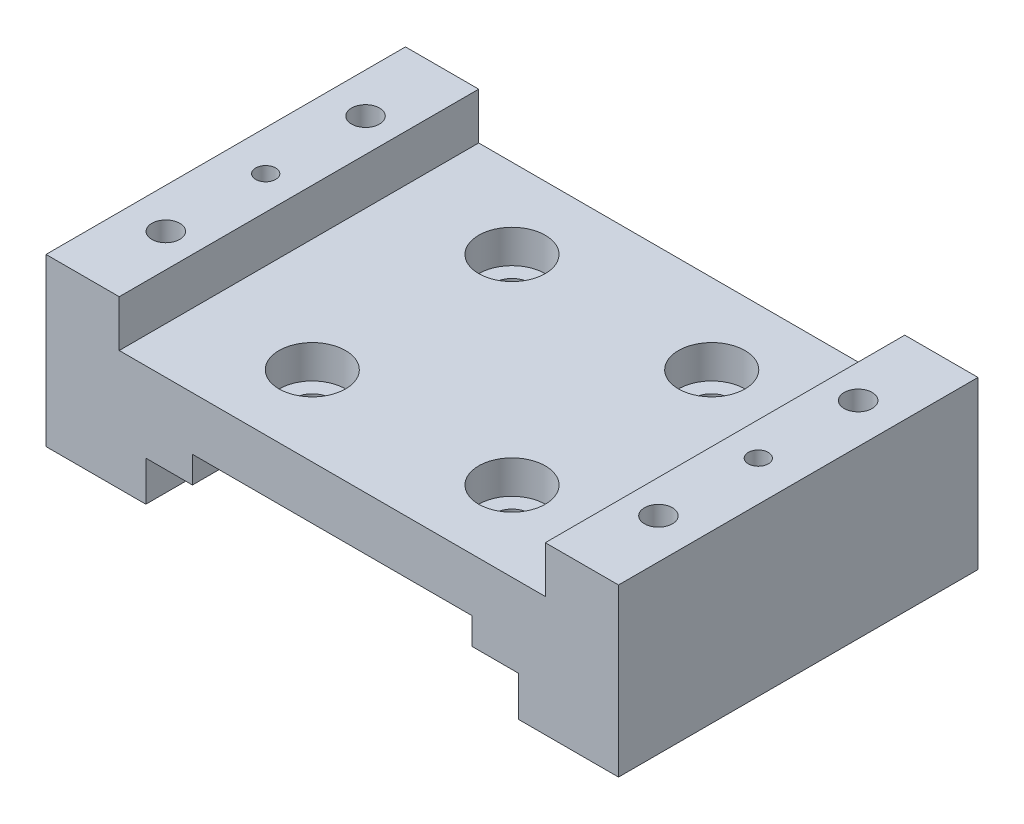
SolidWorks part; units mm, degrees
ref_plane "Front" through (0, 0, 0) normal (0, 0, 1) x (1, 0, 0)
ref_plane "Top" through (0, 0, 0) normal (0, 1, 0) x (1, 0, 0)
ref_plane "Right" through (0, 0, 0) normal (1, 0, 0) x (0, 0, -1)
sketch "Sketch1" plane through (0, 0, 0) normal (0, 0, 1) x (1, 0, 0)
  line L0 (-21, 0) -> (21, 0)
  line L1 (21, 0) -> (21, -4)
  line L2 (21, -4) -> (28, -4)
  line L3 (28, -4) -> (28, -10)
  line L4 (28, -10) -> (43, -10)
  line L5 (43, -10) -> (43, 15)
  line L6 (43, 15) -> (32, 15)
  line L7 (32, 15) -> (32, 8)
  line L8 (32, 8) -> (-32, 8)
  line L9 (0, 8) -> (0, 0) construction
  line L10 (-32, 15) -> (-32, 8)
  line L11 (-43, 15) -> (-32, 15)
  line L12 (-43, -10) -> (-43, 15)
  line L13 (-28, -10) -> (-43, -10)
  line L14 (-28, -4) -> (-28, -10)
  line L15 (-21, -4) -> (-28, -4)
  line L16 (-21, 0) -> (-21, -4)
  dimension "D1" = 25
  dimension "D2" = 6
  dimension "D3" = 4
  dimension "D4" = 8
  dimension "D5" = 7
  dimension "D6" = 43
  dimension "D7" = 11
  dimension "D8" = 15
  dimension "D9" = 7
extrude "Extrude1" add sketch "Sketch1" along normal blind 54
sketch "Sketch2" plane through (0, 15, 0) normal (0, 1, 0) x (1, 0, 0)
  line L0 (32, 0) -> (-32, 0) construction
  line L1 (-37, -12) -> (37, -12) construction
  line L2 (-37, -12) -> (-37, -42) construction
  line L3 (-37, -42) -> (37, -42) construction
  line L4 (37, -12) -> (37, -42) construction
  line L5 (43, -54) -> (43, 0) construction
  dimension "D1" = 30
  dimension "D2" = 74
  dimension "D3" = 12
  dimension "D4" = 6
hole_wizard "M5x0.8 Tapped Hole1" positions "3DSketch1" profile "Sketch3" tap size "M5x0.8" standard "Ansi Metric"
sketch3d "3DSketch1"
  point P0 (-37, 15, 12)
  point P3 (37, 15, 42)
  point P6 (-37, 15, 42)
  point P9 (37, 15, 12)
sketch "Sketch3" plane through (-37, 15, 12) normal (1, 0, 0) x (0, 0, 1)
  line L0 (0, 0) -> (0, 13.2618)
  line L1 (0, 13.2618) -> (2.1, 12)
  line L2 (2.1, 12) -> (2.1, 0)
  line L5 (2.1, 0) -> (0, 0)
  line L10 (0, 13.2618) -> (-2.1, 12) construction
  line L11 (0, -6.35) -> (0, 107.95) construction
  dimension "Tap Drill Dia." = 4.2
  dimension "Tap Drill Depth" = 12
  dimension "Drill Angle" = 118
sketch "Sketch4" plane through (0, 8, 0) normal (0, 1, 0) x (-1, 0, 0)
  line L0 (-32, 54) -> (-32, 0) construction
  line L1 (15, 12) -> (-15, 12) construction
  line L2 (15, 12) -> (15, 42) construction
  line L3 (15, 42) -> (-15, 42) construction
  line L4 (-15, 12) -> (-15, 42) construction
  line L5 (32, 54) -> (32, 0) construction
  line L6 (-32, 54) -> (32, 54) construction
  line L7 (-32, 0) -> (32, 0) construction
  point P4 (-32, 27)
  dimension "D1" = 30
  dimension "D2" = 30
  dimension "D3" = 17
  dimension "D4" = 17
  dimension "D5" = 12
  dimension "D6" = 12
hole_wizard "CBORE for M5 SHCS1" positions "3DSketch2" profile "Sketch5" counterbore size "M5" standard "Ansi Metric"
sketch3d "3DSketch2"
  point P0 (-15, 8, 12)
  point P3 (15, 8, 12)
  point P6 (15, 8, 42)
  point P9 (-15, 8, 42)
sketch "Sketch5" plane through (-15, 8, 12) normal (1, 0, 0) x (0, 0, 1)
  line L0 (0, 0) -> (0, 18)
  line L1 (0, 18) -> (2.65, 18)
  line L3 (2.65, 18) -> (2.65, 5)
  line L4 (2.65, 5) -> (5, 5)
  line L5 (5, 5) -> (5, 0)
  line L7 (5, 0) -> (0, 0)
  line L11 (0, -6.35) -> (0, 107.95) construction
  dimension "Thru Hole Dia." = 5.3
  dimension "Thru Hole Depth" = 18
  dimension "C'Bore Dia." = 10
  dimension "C'Bore Depth" = 5
sketch "Sketch8" plane through (0, -10, 0) normal (0, -1, 0) x (1, 0, 0)
  line L0 (-43, 54) -> (-43, 0) construction
  line L1 (-37, 31) -> (37, 31) construction
  line L2 (-37, 31) -> (-37, 23) construction
  line L3 (-37, 23) -> (37, 23) construction
  line L4 (37, 31) -> (37, 23) construction
  line L5 (43, 54) -> (43, 0) construction
  line L6 (-21, 54) -> (21, 54) construction
  line L7 (-21, 0) -> (21, 0) construction
  dimension "D1" = 8
  dimension "D2" = 74
  dimension "D3" = 6
  dimension "D4" = 6
  dimension "D5" = 23
  dimension "D6" = 23
hole_wizard "M2.5x0.45 Tapped Hole2" positions "3DSketch4" profile "Sketch9" tap size "M2.5x0.45" standard "Ansi Metric"
sketch3d "3DSketch4"
  point P1 (-37, -10, 31)
  point P4 (-37, -10, 23)
  point P7 (37, -10, 31)
  point P10 (37, -10, 23)
sketch "Sketch9" plane through (-37, -10, 31) normal (1, 0, 0) x (0, 0, -1)
  line L0 (0, 0) -> (0, 7.8659)
  line L1 (0, 7.8659) -> (1.025, 7.25)
  line L2 (1.025, 7.25) -> (1.025, 0)
  line L5 (1.025, 0) -> (0, 0)
  line L10 (0, 7.8659) -> (-1.025, 7.25) construction
  line L11 (0, -6.35) -> (0, 107.95) construction
  dimension "Tap Drill Dia." = 2.05
  dimension "Tap Drill Depth" = 7.25
  dimension "Drill Angle" = 118
sketch "Sketch10" plane through (0, 15, 0) normal (0, 1, 0) x (1, 0, 0)
  line L0 (-37, -27) -> (37, -27) construction
  line L1 (-43, -54) -> (-43, 0) construction
  circle A0 centre (-37, -27) radius 1.5
  circle A1 centre (37, -27) radius 1.5
  point P4 (0, -27)
  point P8 (-43, -27)
  dimension "D1" = 3
  dimension "D2" = 74
extrude "Cut-Extrude1" cut sketch "Sketch10" against normal blind 3.3
